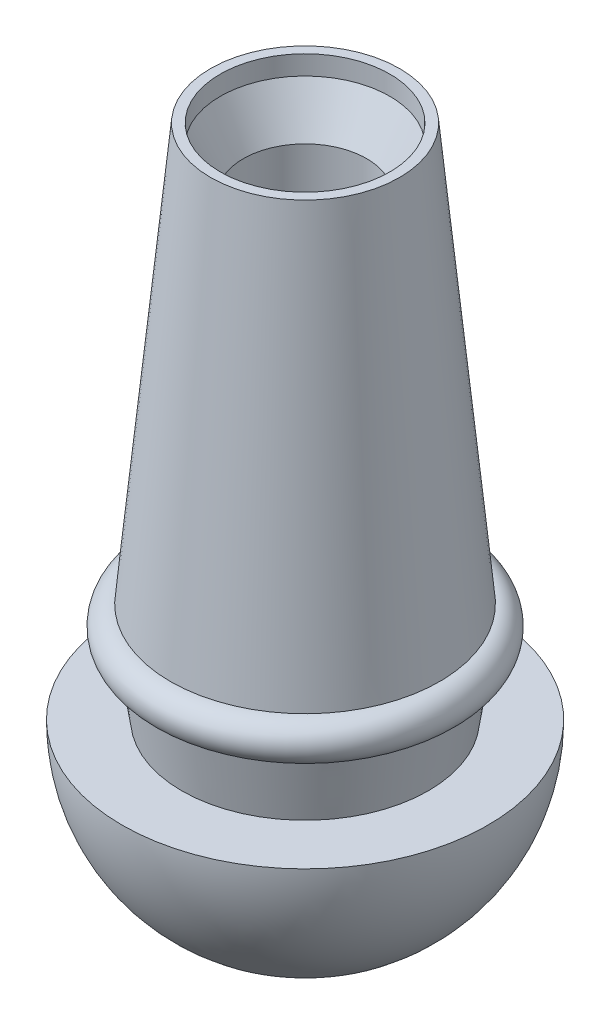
SolidWorks part; units mm, degrees
ref_plane "Face" through (0, 0, 0) normal (0, 0, 1) x (1, 0, 0)
ref_plane "Dessus" through (0, 0, 0) normal (0, 1, 0) x (1, 0, 0)
ref_plane "Droite" through (0, 0, 0) normal (1, 0, 0) x (0, 0, -1)
sketch "Esquisse1" plane through (0, 0, 0) normal (0, 0, 1) x (1, 0, 0)
  line L0 (44, 0) -> (49, 0)
  line L2 (49, 0) -> (69.8458, -216.0012)
  line L3 (68.8302, -235.9313) -> (64, -268)
  line L4 (64, -268) -> (94.8683, -268)
  line L5 (44, 0) -> (44, -10)
  line L7 (44, -10) -> (32, -32)
  line L8 (32, -32) -> (32, -163)
  line L9 (32, -163) -> (30, -182.2)
  line L10 (30, -182.2) -> (30, -358)
  line L11 (0, 0) -> (0, -536) construction
  arc A0 (94.8683, -268) -> (30, -358) centre (0, -268) cw
  arc A1 (69.8458, -216.0012) -> (68.8302, -235.9313) centre (70, -226) cw
  dimension "D13" = 10
  dimension "D1" = 5
  dimension "D2" = 44
  dimension "D3" = 10
  dimension "D4" = 32
  dimension "D5" = 22
  dimension "D6" = 131
  dimension "D7" = 30
  dimension "D8" = 19.2
  dimension "D9" = 358
  dimension "D10" = 268
  dimension "D11" = 64
  dimension "D12" = 70
  dimension "D14" = 42
revolve "Révolution1" add sketch "Esquisse1" angle 360 about L11
